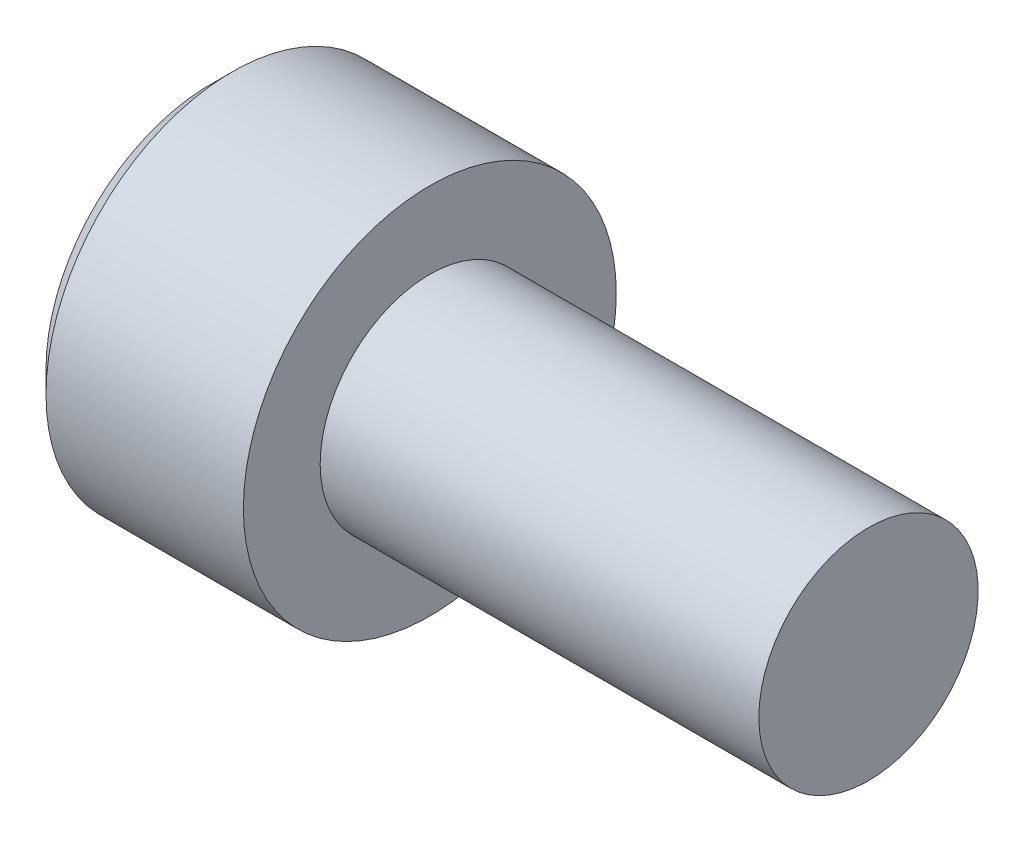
SolidWorks part; units mm, degrees
ref_plane "Front Plane" through (0, 0, 0) normal (0, 0, 1) x (1, 0, 0)
ref_plane "Top Plane" through (0, 0, 0) normal (0, 1, 0) x (1, 0, 0)
ref_plane "Right Plane" through (0, 0, 0) normal (1, 0, 0) x (0, 0, -1)
sketch "Sketch1" plane through (0, 0, 0) normal (0, 0, 1) x (1, 0, 0)
  line L0 (-5, 0) -> (10, 0) construction
  line L1 (0, 2.5) -> (10, 2.5)
  line L3 (-5, 0) -> (10, 0)
  line L4 (10, 2.5) -> (10, 0)
  line L6 (0, 2.5) -> (0, 4.25)
  line L7 (0, 4.25) -> (-5, 4.25)
  line L8 (-5, 0) -> (-5, 4.25)
  dimension "MSM_1" = 10
  dimension "M" = 5
  dimension "MSM_2" = 5
  dimension "MSM_3" = 8.5
revolve "Revolve1" add sketch "Sketch1" angle 360 about L0
sketch "Sketch2" plane through (-5, 0, 0) normal (-1, 0, 0) x (0, 0, 1)
  line L0 (0, -4.675) -> (0, 4.675) construction
  line L1 (2, 1.1547) -> (0, 2.3094)
  line L2 (0, 2.3094) -> (-2, 1.1547)
  line L3 (-2, 1.1547) -> (-2, -1.1547)
  line L4 (-2, -1.1547) -> (0, -2.3094)
  line L5 (0, -2.3094) -> (2, -1.1547)
  line L6 (2, -1.1547) -> (2, 1.1547)
  circle A0 centre (0, 0) radius 2 construction
  dimension "MSM_4" = 4
extrude "Cut-Extrude1" cut sketch "Sketch2" against normal blind 2.5
chamfer "Chamfer1" distance 0.5 1 edges at (-5, 0, 4.25)
